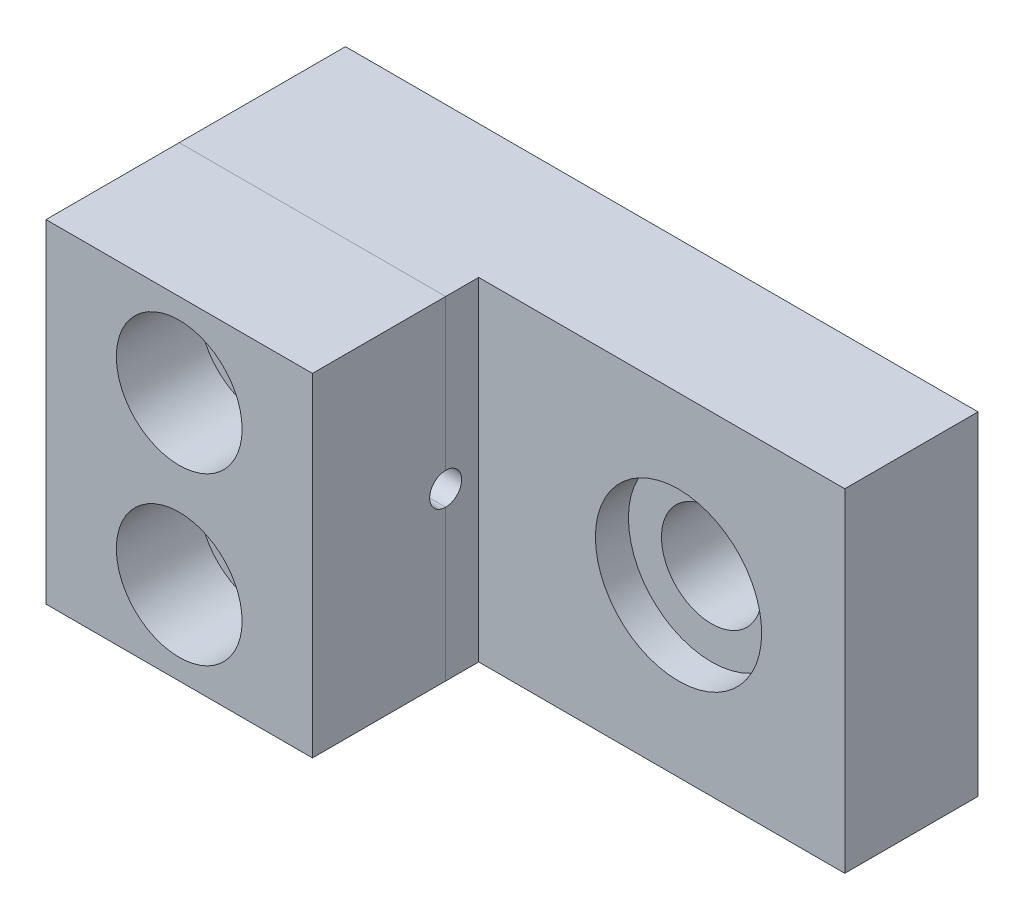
SolidWorks part; units mm, degrees
ref_plane "Front Plane" through (0, 0, 0) normal (0, 0, 1) x (1, 0, 0)
ref_plane "Top Plane" through (0, 0, 0) normal (0, 1, 0) x (1, 0, 0)
ref_plane "Right Plane" through (0, 0, 0) normal (1, 0, 0) x (0, 0, -1)
sketch "Sketch1" plane through (0, 0, 0) normal (0, 0, 1) x (1, 0, 0)
  line L0 (0, 0) -> (-47.7207, 0) construction
  line L1 (-22.225, -7.9375) -> (7.9248, -7.9375)
  line L2 (7.9248, -7.9375) -> (7.9248, 7.9375)
  line L3 (7.9248, 7.9375) -> (-22.225, 7.9375)
  line L4 (-22.225, 7.9375) -> (-22.225, -7.9375)
  line L5 (-9.525, 7.9375) -> (-9.525, -7.9375)
  circle A0 centre (0, 0) radius 2.3876
  circle A1 centre (-15.875, 3.9624) radius 1.7272
  circle A2 centre (-15.875, -3.9624) radius 1.7272
  circle A3 centre (-15.875, 3.9624) radius 2.9972
  circle A4 centre (-15.875, -3.9624) radius 2.9972
  dimension "D1" = 4.7752
  dimension "D2" = 3.4544
  dimension "D6" = 5.9944
  dimension "D3" = 15.875
  dimension "D4" = 7.9248
  dimension "D5" = 15.875
  dimension "D7" = 7.9248
  dimension "D8" = 6.35
  dimension "D9" = 12.7
sketch "Sketch2" plane through (0, 0, 0) normal (0, 0, 1) x (1, 0, 0)
  line L0 (-22.225, -7.9375) -> (7.9248, -7.9375) construction
  line L1 (7.9248, -7.9375) -> (7.9248, 7.9375) construction
  line L2 (7.9248, 7.9375) -> (-22.225, 7.9375) construction
  line L3 (-22.225, 7.9375) -> (-22.225, -7.9375) construction
  line L4 (-22.225, -7.9375) -> (7.9248, -7.9375)
  line L5 (7.9248, -7.9375) -> (7.9248, 7.9375)
  line L6 (7.9248, 7.9375) -> (-22.225, 7.9375)
  line L7 (-22.225, 7.9375) -> (-22.225, -7.9375)
  circle A0 centre (0, 0) radius 2.3876 construction
  circle A1 centre (-15.875, -3.9624) radius 1.7272 construction
  circle A2 centre (-15.875, 3.9624) radius 1.7272 construction
  circle A3 centre (0, 0) radius 2.3876
  circle A4 centre (-15.875, -3.9624) radius 1.7272
  circle A5 centre (-15.875, 3.9624) radius 1.7272
extrude "Boss-Extrude1" add sketch "Sketch2" along normal blind 6.35
sketch "Sketch3" plane through (0, 0, 0) normal (0, 0, 1) x (1, 0, 0)
  line L0 (-22.225, -7.9375) -> (7.9248, -7.9375) construction
  line L1 (-22.225, 7.9375) -> (-22.225, -7.9375) construction
  line L2 (7.9248, 7.9375) -> (-22.225, 7.9375) construction
  line L3 (-9.525, 7.9375) -> (-9.525, -7.9375) construction
  line L4 (-22.225, -7.9375) -> (-9.525, -7.9375)
  line L5 (-22.225, 7.9375) -> (-22.225, -7.9375)
  line L6 (-9.525, 7.9375) -> (-22.225, 7.9375)
  line L7 (-9.525, 7.9375) -> (-9.525, -7.9375)
  circle A0 centre (-15.875, -3.9624) radius 1.7272 construction
  circle A1 centre (-15.875, 3.9624) radius 1.7272 construction
  circle A2 centre (-15.875, -3.9624) radius 1.7272
  circle A3 centre (-15.875, 3.9624) radius 1.7272
extrude "Boss-Extrude2" add sketch "Sketch3" along normal blind 7.9248
sketch "Sketch4" plane through (0, 0, 7.9248) normal (0, 0, 1) x (1, 0, 0)
  line L0 (-9.525, -7.9375) -> (-9.525, 7.9375) construction
  line L1 (-9.525, 7.9375) -> (-22.225, 7.9375) construction
  line L2 (-22.225, 7.9375) -> (-22.225, -7.9375) construction
  line L3 (-22.225, -7.9375) -> (-9.525, -7.9375) construction
  line L4 (-9.525, -7.9375) -> (-9.525, 7.9375)
  line L5 (-9.525, 7.9375) -> (-22.225, 7.9375)
  line L6 (-22.225, 7.9375) -> (-22.225, -7.9375)
  line L7 (-22.225, -7.9375) -> (-9.525, -7.9375)
  circle A0 centre (-15.875, -3.9624) radius 1.7272 construction
  circle A1 centre (-15.875, 3.9624) radius 1.7272 construction
  circle A2 centre (-15.875, -3.9624) radius 1.7272
  circle A3 centre (-15.875, 3.9624) radius 1.7272
extrude "Boss-Extrude3" add sketch "Sketch4" along normal blind 6.35 separate body
sketch "Sketch5" plane through (-22.225, 0, 0) normal (-1, 0, 0) x (0, 0, 1)
  line L0 (7.9248, 7.9375) -> (7.9248, -7.9375) construction
  circle A0 centre (7.9248, 0) radius 0.762
  dimension "D1" = 1.524
extrude "Cut-Extrude1" cut sketch "Sketch5" against normal blind 14.605
sketch "Sketch6" plane through (0, 0, 14.2748) normal (0, 0, 1) x (1, 0, 0)
  circle A0 centre (-15.875, 3.9624) radius 2.9972 construction
  circle A1 centre (-15.875, -3.9624) radius 2.9972 construction
  circle A2 centre (-15.875, 3.9624) radius 2.9972
  circle A3 centre (-15.875, -3.9624) radius 2.9972
extrude "Cut-Extrude2" cut sketch "Sketch6" against normal blind 3.9624
sketch "Sketch7" plane through (0, 0, 6.35) normal (0, 0, 1) x (1, 0, 0)
  circle A0 centre (0, 0) radius 3.9624
  dimension "D1" = 7.9248
extrude "Cut-Extrude3" cut sketch "Sketch7" against normal blind 1.5748
